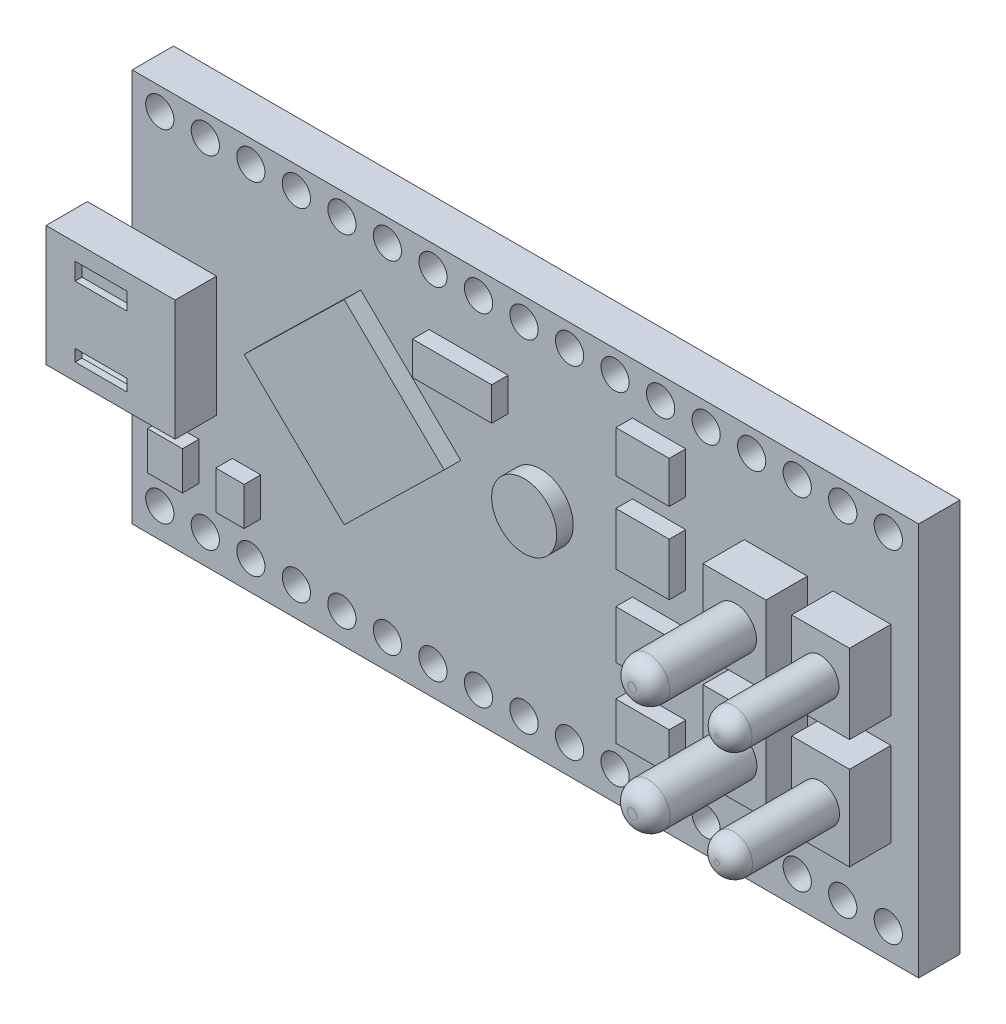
SolidWorks part; units mm, degrees
ref_plane "정면" through (0, 0, 0) normal (0, 0, 1) x (1, 0, 0)
ref_plane "윗면" through (0, 0, 0) normal (0, 1, 0) x (1, 0, 0)
ref_plane "우측면" through (0, 0, 0) normal (1, 0, 0) x (0, 0, -1)
sketch "스케치1" plane through (0, 0, 0) normal (0, 0, 1) x (1, 0, 0)
  line L1 (-58.2579, -21.0861) -> (-54.4579, -21.0861)
  line L2 (-58.2579, -21.0861) -> (-58.2579, -22.9861)
  line L3 (-58.2579, -22.9861) -> (-54.4579, -22.9861)
  line L4 (-54.4579, -21.0861) -> (-54.4579, -22.9861)
extrude "보스-돌출1" add sketch "스케치1" along normal blind 0.2
sketch "스케치2" plane through (0, 0, 0.2) normal (0, 0, 1) x (1, 0, 0)
  line L1 (-58.4742, -21.7453) -> (-57.8503, -21.7453)
  line L2 (-58.4742, -21.7453) -> (-58.4742, -22.3276)
  line L3 (-58.4742, -22.3276) -> (-57.8503, -22.3276)
  line L4 (-57.8503, -21.7453) -> (-57.8503, -22.3276)
extrude "보스-돌출2" add sketch "스케치2" along normal blind 0.2
sketch "스케치3" plane through (0, 0, 0.4) normal (0, 0, 1) x (1, 0, 0)
  line L1 (-58.3335, -21.8245) -> (-58.0833, -21.8245)
  line L2 (-58.3335, -21.8245) -> (-58.3335, -21.9079)
  line L3 (-58.3335, -21.9079) -> (-58.0833, -21.9079)
  line L4 (-58.0833, -21.8245) -> (-58.0833, -21.9079)
  line L5 (-58.3335, -22.1893) -> (-58.0833, -22.1893)
  line L6 (-58.3335, -22.1893) -> (-58.3335, -22.2466)
  line L7 (-58.3335, -22.2466) -> (-58.0833, -22.2466)
  line L8 (-58.0833, -22.1893) -> (-58.0833, -22.2466)
extrude "컷-돌출1" cut sketch "스케치3" against normal blind 0.1
sketch "스케치4" plane through (-58.4742, 0, 0) normal (-1, 0, 0) x (0, 0, 1)
  line L1 (0.2504, -21.8036) -> (0.3666, -21.8036)
  line L2 (0.2504, -21.8036) -> (0.2504, -22.2802)
  line L3 (0.2504, -22.2802) -> (0.3666, -22.2802)
  line L4 (0.3666, -21.8036) -> (0.3666, -22.2802)
extrude "컷-돌출2" cut sketch "스케치4" against normal blind 0.5
sketch "스케치5" plane through (0, 0, 0.2) normal (0, 0, 1) x (1, 0, 0)
  line L0 (-57.1536, -21.4551) -> (-57.6368, -21.9262)
  line L2 (-56.8233, -21.4551) -> (-56.4408, -21.4551)
  line L3 (-56.8233, -21.4551) -> (-56.8233, -21.6162)
  line L4 (-56.8233, -21.6162) -> (-56.4408, -21.6162)
  line L5 (-57.6368, -21.9262) -> (-57.1536, -22.3974)
  line L6 (-57.1536, -22.3974) -> (-56.6703, -21.9262)
  line L7 (-56.6703, -21.9262) -> (-57.1536, -21.4551)
  line L8 (-56.4408, -21.4551) -> (-56.4408, -21.6162)
  line L9 (-58.1039, -22.4699) -> (-57.9348, -22.4699)
  line L10 (-58.1039, -22.4699) -> (-58.1039, -22.6551)
  line L11 (-58.1039, -22.6551) -> (-57.9348, -22.6551)
  line L12 (-57.9348, -22.4699) -> (-57.9348, -22.6551)
  line L13 (-57.7737, -22.4699) -> (-57.6368, -22.4699)
  line L14 (-57.7737, -22.4699) -> (-57.7737, -22.6551)
  line L15 (-57.7737, -22.6551) -> (-57.6368, -22.6551)
  line L16 (-57.6368, -22.4699) -> (-57.6368, -22.6551)
  line L17 (-55.8407, -21.3343) -> (-55.583, -21.3343)
  line L18 (-55.8407, -21.3343) -> (-55.8407, -21.5356)
  line L19 (-55.8407, -21.5356) -> (-55.583, -21.5356)
  line L20 (-55.583, -21.3343) -> (-55.583, -21.5356)
  line L21 (-55.8407, -21.6725) -> (-55.583, -21.6725)
  line L22 (-55.8407, -21.6725) -> (-55.8407, -21.9262)
  line L23 (-55.8407, -21.9262) -> (-55.583, -21.9262)
  line L24 (-55.583, -21.6725) -> (-55.583, -21.9262)
  line L25 (-55.8407, -22.0833) -> (-55.583, -22.0833)
  line L26 (-55.8407, -22.0833) -> (-55.8407, -22.3169)
  line L27 (-55.8407, -22.3169) -> (-55.583, -22.3169)
  line L28 (-55.583, -22.0833) -> (-55.583, -22.3169)
  line L29 (-55.8407, -22.4699) -> (-55.583, -22.4699)
  line L30 (-55.8407, -22.4699) -> (-55.8407, -22.6551)
  line L31 (-55.8407, -22.6551) -> (-55.583, -22.6551)
  line L32 (-55.583, -22.4699) -> (-55.583, -22.6551)
  circle A0 centre (-56.2837, -21.9262) radius 0.1571
extrude "보스-돌출3" add sketch "스케치5" along normal blind 0.08
sketch "스케치6" plane through (0, 0, 0.2) normal (0, 0, 1) x (1, 0, 0)
  circle A0 centre (-58.1244, -21.1942) radius 0.0682
  circle A1 centre (-57.9044, -21.1942) radius 0.0682
  circle A2 centre (-57.6844, -21.1942) radius 0.0682
  circle A3 centre (-57.4644, -21.1942) radius 0.0682
  circle A4 centre (-57.2444, -21.1942) radius 0.0682
  circle A5 centre (-57.0244, -21.1942) radius 0.0682
  circle A6 centre (-56.8044, -21.1942) radius 0.0682
  circle A7 centre (-56.5844, -21.1942) radius 0.0682
  circle A8 centre (-56.3644, -21.1942) radius 0.0682
  circle A9 centre (-56.1444, -21.1942) radius 0.0682
  circle A10 centre (-55.9244, -21.1942) radius 0.0682
  circle A11 centre (-55.7044, -21.1942) radius 0.0682
  circle A12 centre (-55.4844, -21.1942) radius 0.0682
  circle A13 centre (-55.2644, -21.1942) radius 0.0682
  circle A14 centre (-55.0444, -21.1942) radius 0.0682
  circle A15 centre (-54.8244, -21.1942) radius 0.0682
  circle A16 centre (-54.6044, -21.1942) radius 0.0682
  circle A17 centre (-57.9044, -22.8442) radius 0.0682
  circle A18 centre (-57.6844, -22.8442) radius 0.0682
  circle A19 centre (-57.4644, -22.8442) radius 0.0682
  circle A20 centre (-57.2444, -22.8442) radius 0.0682
  circle A21 centre (-57.0244, -22.8442) radius 0.0682
  circle A22 centre (-56.8044, -22.8442) radius 0.0682
  circle A23 centre (-56.5844, -22.8442) radius 0.0682
  circle A24 centre (-56.3644, -22.8442) radius 0.0682
  circle A25 centre (-56.1444, -22.8442) radius 0.0682
  circle A26 centre (-55.9244, -22.8442) radius 0.0682
  circle A27 centre (-55.7044, -22.8442) radius 0.0682
  circle A28 centre (-55.4844, -22.8442) radius 0.0682
  circle A29 centre (-55.2644, -22.8442) radius 0.0682
  circle A30 centre (-55.0444, -22.8442) radius 0.0682
  circle A31 centre (-54.8244, -22.8442) radius 0.0682
  circle A32 centre (-54.6044, -22.8442) radius 0.0682
  circle A33 centre (-58.1244, -22.8442) radius 0.0682
  dimension "D1" = 17
  dimension "D2" = 2
extrude "컷-돌출3" cut sketch "스케치6" against normal blind 0.2
sketch "스케치8" plane through (0, 0, 0.2) normal (0, 0, 1) x (1, 0, 0)
  line L1 (-55.3001, -21.5731) -> (-54.9951, -21.5731)
  line L2 (-55.3001, -21.5731) -> (-55.3001, -21.9557)
  line L3 (-55.3001, -21.9557) -> (-54.9951, -21.9557)
  line L4 (-54.9951, -21.5731) -> (-54.9951, -21.9557)
  line L5 (-54.871, -21.5731) -> (-54.5918, -21.5731)
  line L6 (-54.871, -21.5731) -> (-54.871, -21.9557)
  line L7 (-54.871, -21.9557) -> (-54.5918, -21.9557)
  line L8 (-54.5918, -21.5731) -> (-54.5918, -21.9557)
  line L9 (-55.3001, -22.0798) -> (-54.9951, -22.0798)
  line L10 (-55.3001, -22.0798) -> (-55.3001, -22.4883)
  line L11 (-55.3001, -22.4883) -> (-54.9951, -22.4883)
  line L12 (-54.9951, -22.0798) -> (-54.9951, -22.4883)
  line L13 (-54.871, -22.0798) -> (-54.5918, -22.0798)
  line L14 (-54.871, -22.0798) -> (-54.871, -22.4883)
  line L15 (-54.871, -22.4883) -> (-54.5918, -22.4883)
  line L16 (-54.5918, -22.0798) -> (-54.5918, -22.4883)
extrude "보스-돌출4" add sketch "스케치8" along normal blind 0.2
sketch "스케치9" plane through (0, 0, 0.4) normal (0, 0, 1) x (1, 0, 0)
  circle A0 centre (-55.1423, -21.762) radius 0.1008
  circle A1 centre (-54.7322, -21.762) radius 0.0893
  circle A2 centre (-54.7322, -22.2915) radius 0.0918
  circle A3 centre (-55.1423, -22.2915) radius 0.103
extrude "보스-돌출5" add sketch "스케치9" along normal blind 0.5
fillet "필렛3" radius 0.08 4 edges at (-55.0415, -21.762, 0.9) (-54.6429, -21.762, 0.9) (-54.6404, -22.2915, 0.9) (-55.0393, -22.2915, 0.9)
